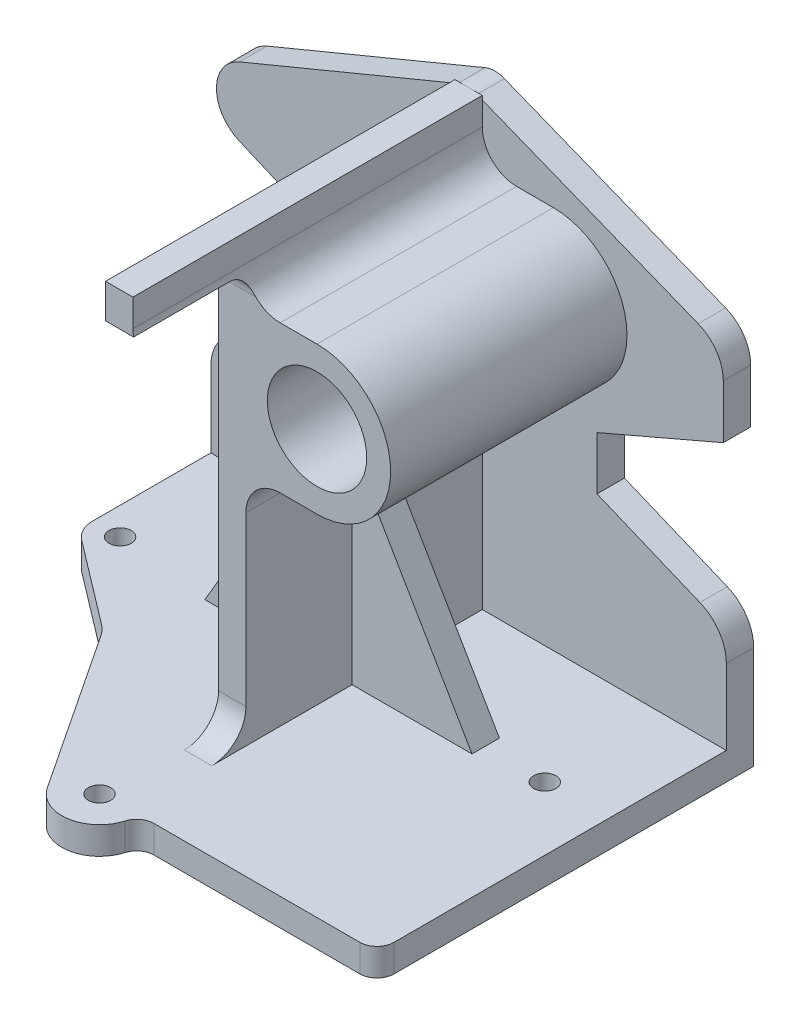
SolidWorks part; units mm, degrees
ref_plane "Plane1" through (0, 0, 0) normal (0, 0, 1) x (1, 0, 0)
ref_plane "Plane2" through (0, 0, 0) normal (0, 1, 0) x (1, 0, 0)
ref_plane "Plane3" through (0, 0, 0) normal (1, 0, 0) x (0, 0, -1)
sketch "Esquisse1" plane through (0, 0, 0) normal (0, 0, 1) x (1, 0, 0)
  line L0 (-150.5, 0) -> (150.5, 0)
  line L1 (75, 139) -> (75, 108)
  line L3 (148.7303, 170.7373) -> (148.7303, 202)
  line L4 (-75, 156.6605) -> (-75, 108)
  line L7 (-6.3816, 274.8572) -> (-133.8089, 222.0497)
  line L9 (4.9021, 274.939) -> (134.0814, 223.5872)
  line L10 (-135.0744, 83.094) -> (-75, 108)
  line L11 (-75, 156.6605) -> (-134.0733, 182.062)
  line L12 (135.0744, 83.0939) -> (75, 108)
  line L13 (-150.5, 0) -> (-150.5, 60)
  line L14 (148.7303, 170.7373) -> (75, 139)
  line L15 (150.5, 0) -> (150.5, 60)
  arc A0 (-135.0744, 83.094) -> (-150.5, 60) centre (-125.5, 60) ccw
  arc A1 (-133.8089, 222.0497) -> (-134.0733, 182.062) centre (-125.5, 202) ccw
  arc A2 (148.7303, 202) -> (134.0814, 223.5872) centre (125.5, 202) ccw
  arc A3 (150.5, 60) -> (135.0744, 83.0939) centre (125.5, 60) ccw
  arc A4 (4.9021, 274.939) -> (-6.3816, 274.8572) centre (-0.639, 261) ccw
  dimension "D4" = 202
  dimension "D15" = 108
  dimension "D17" = 156.6605
  dimension "D18" = 139
  dimension "D2" = 15
  dimension "D1" = 301
  dimension "D3" = 60
  dimension "D5" = 60
  dimension "D6" = 202
  dimension "D7" = 125.5
  dimension "D8" = 125.5
  dimension "D9" = 125.5
  dimension "D10" = 125.5
  dimension "D11" = 261
  dimension "D12" = 150.5
  dimension "D13" = 75
  dimension "D14" = 75
  dimension "D16" = 108
  dimension "D19" = 170.7373
  dimension "D20" = 182.062
extrude "Base-Extrusion" add sketch "Esquisse1" along normal blind 16
sketch "Esquisse2" plane through (0, 0, 0) normal (0, -1, 0) x (1, 0, 0)
  line L0 (-150.5, 0) -> (150.5, 0) construction
  line L1 (-150.5, 0) -> (150.5, 0)
  line L2 (-150.5, 0) -> (-150.5, 85)
  line L3 (20.2083, 220) -> (140.5, 220)
  line L4 (-28.8451, 233.1433) -> (-90.5, 140)
  line L5 (150.5, 0) -> (150.5, 210)
  line L6 (-144.1907, 97.7315) -> (-95.0639, 135.125)
  arc A0 (-150.5, 85) -> (-144.1907, 97.7315) centre (-134.5, 85) cw
  arc A1 (-90.5, 140) -> (-95.0639, 135.125) centre (-107.1773, 151.0393) cw
  arc A2 (-28.8451, 233.1433) -> (10.612, 227.1875) centre (-10.5, 221) cw
  arc A3 (150.5, 210) -> (140.5, 220) centre (140.5, 210) ccw
  arc A4 (20.2083, 220) -> (10.612, 227.1875) centre (20.2083, 230) cw
  point P6 (-150.5, 92.9291)
  point P14 (-29.5, 220)
  point P17 (150.5, 220)
  dimension "D5" = 136
  dimension "D4" = 10
  dimension "D6" = 20
  dimension "D9" = 22
  dimension "D1" = 221
  dimension "D2" = 161
  dimension "D3" = 124
  dimension "D7" = 140
  dimension "D8" = 60
  dimension "D10" = 220
extrude "Boss.-Extru.1" add sketch "Esquisse2" against normal blind 16
sketch "Esquisse4" plane through (0, 0, 0) normal (1, 0, 0) x (0, 0, -1)
  line L0 (-16, 276) -> (-16, 16)
  line L2 (-16, 16) -> (-174, 16)
  line L3 (-154, 246) -> (-154, 36)
  line L4 (-16, 139) -> (-16, 108) construction
  line L5 (-164, 256) -> (-220, 256)
  line L6 (-220, 256) -> (-220, 276)
  line L7 (-220, 276) -> (-16, 276)
  line L9 (-16, 16) -> (-210, 16) construction
  arc A0 (-174, 16) -> (-154, 36) centre (-174, 36) ccw
  arc A1 (-154, 246) -> (-164, 256) centre (-164, 246) ccw
  dimension "D4" = 20
  dimension "D5" = 10
  dimension "D1" = 20
  dimension "D2" = 204
  dimension "D3" = 138
  dimension "D6" = 260
extrude "Boss.-Extru.2" add sketch "Esquisse4" along normal mid plane 16
sketch "Esquisse3" plane through (0, 0, 16) normal (0, 0, 1) x (1, 0, 0)
  line L0 (8, 246) -> (8, 36) construction
  line L1 (8, 240) -> (8, 154)
  line L2 (49.5, 240) -> (8, 240)
  line L3 (8, 154) -> (49.5, 154)
  arc A1 (49.5, 154) -> (49.5, 240) centre (49.5, 197) ccw
  dimension "D3" = 43
  dimension "D1" = 197
  dimension "D2" = 101
extrude "Boss.-Extru.3" add sketch "Esquisse3" along normal blind 138
fillet "Congé1" radius 20 2 edges at (8, 240, 85) (8, 154, 85)
sketch "Esquisse5" plane through (0, 0, 154) normal (0, 0, 1) x (1, 0, 0)
  circle A0 centre (49.5, 197) radius 29
  arc A1 (49.5, 154) -> (49.5, 240) centre (49.5, 197) ccw construction
  dimension "D1" = 58
extrude "Enlèv. mat.-Extru.1" cut sketch "Esquisse5" against normal through all
ref_plane "PlanNervure" through (0, 0, 84) normal (0, 0, 1) x (1, 0, 0)
sketch "Esquisse6" plane through (0, 0, 84) normal (0, 0, 1) x (1, 0, 0)
  line L0 (8, 136) -> (78, 16)
  line L2 (8, 134) -> (8, 36) construction
  line L3 (20.2083, 16) -> (140.5, 16) construction
  dimension "D1" = 70
  dimension "D2" = 120
rib "Nervure1" sketch "Esquisse6" sketch "Esquisse6" thickness 16 extrusion direction parallel to sketch draft on no parameters "D1"=16
sketch "Esquisse7" plane through (0, 0, 84) normal (0, 0, 1) x (1, 0, 0)
  line L0 (-10.5, 131) -> (-78, 16)
  line L1 (-10.5, 16) -> (-10.5, 0) construction
  line L2 (-144.1907, 16) -> (-95.0639, 16) construction
  dimension "D1" = 70
  dimension "D2" = 115
rib "Nervure3" sketch "Esquisse7" sketch "Esquisse7" thickness 16 extrusion direction parallel to sketch draft on no parameters "D1"=16
sketch "Esquisse9" plane through (0, 16, 0) normal (0, 1, 0) x (-1, 0, 0)
  circle A0 centre (10.5, 221) radius 6.5
  arc A2 (28.8451, 233.1433) -> (-10.612, 227.1875) centre (10.5, 221) ccw construction
  circle A3 centre (-113.5, 85) radius 6.5
  circle A4 centre (134.5, 85) radius 6.5
  dimension "D1" = 13
  dimension "D2" = 13
  dimension "D5" = 13
  dimension "D7" = 124
  dimension "D3" = 136
  dimension "D4" = 124
  dimension "D6" = 136
extrude "Enlèv. mat.-Extru.2" cut sketch "Esquisse9" against normal through all
